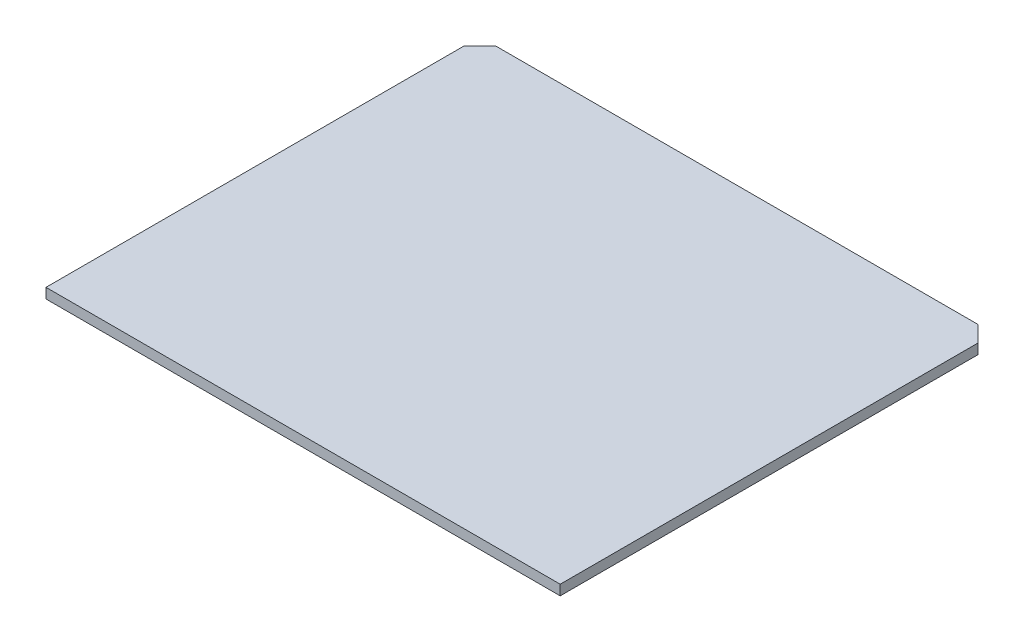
SolidWorks part; units mm, degrees
ref_plane "Front Plane" through (0, 0, 0) normal (0, 0, 1) x (1, 0, 0)
ref_plane "Top Plane" through (0, 0, 0) normal (0, 1, 0) x (1, 0, 0)
ref_plane "Right Plane" through (0, 0, 0) normal (1, 0, 0) x (0, 0, -1)
sketch "Sketch1" plane through (0, 0, 0) normal (0, 1, 0) x (1, 0, 0)
  line L1 (-40.64, 34.29) -> (40.64, 34.29)
  line L2 (-40.64, 34.29) -> (-40.64, -34.29)
  line L3 (-40.64, -34.29) -> (40.64, -34.29)
  line L4 (40.64, 34.29) -> (40.64, -34.29)
  line L5 (-40.64, 34.29) -> (40.64, -34.29) construction
  line L6 (-40.64, -34.29) -> (40.64, 34.29) construction
  point P0 (0, 0)
  dimension "D1" = 81.28
  dimension "D2" = 68.58
extrude "Boss-Extrude1" add sketch "Sketch1" along normal blind 1.6
chamfer "Chamfer1" distance 2.54 angle 45 2 edges at (40.64, 0.8, -34.29) (-40.64, 0.8, -34.29)
